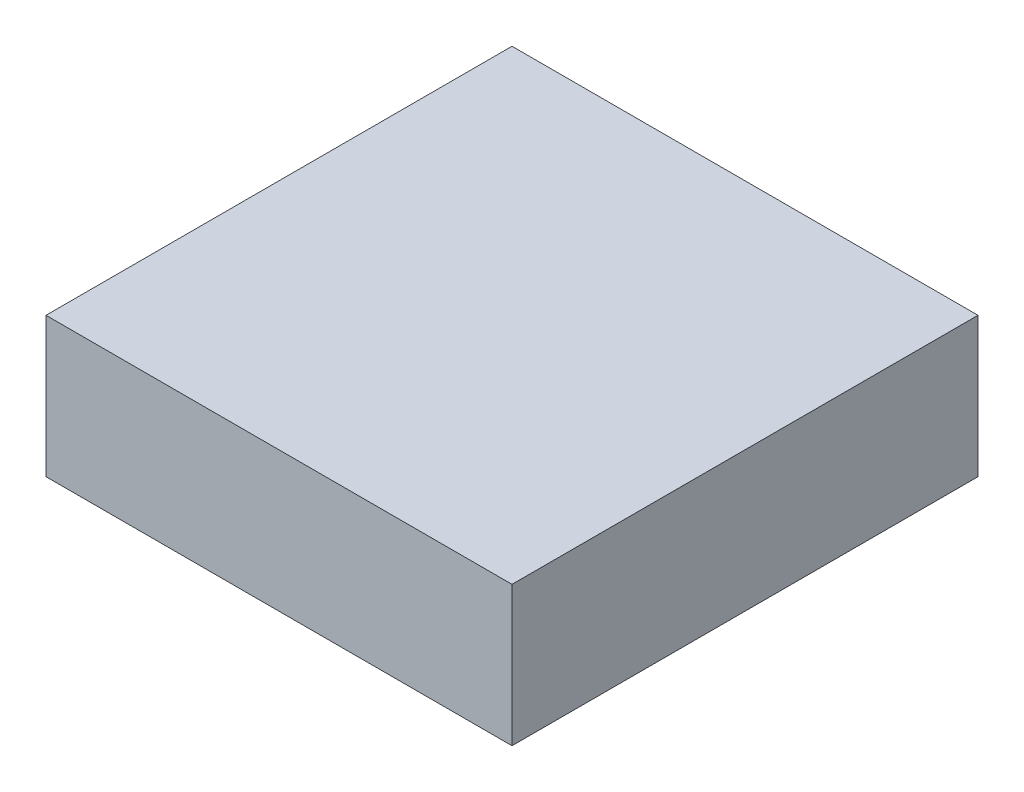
SolidWorks part; units mm, degrees
ref_plane "Front" through (0, 0, 0) normal (0, 0, 1) x (1, 0, 0)
ref_plane "Top" through (0, 0, 0) normal (0, 1, 0) x (1, 0, 0)
ref_plane "Right" through (0, 0, 0) normal (1, 0, 0) x (0, 0, -1)
sketch "Sketch1" plane through (0, 0, 0) normal (0, 0, 1) x (1, 0, 0)
  line L4 (-2.5, 4.25) -> (-2.5, 2.75)
  line L5 (-2.5, 2.75) -> (2.5, 2.75)
  line L6 (2.5, 2.75) -> (2.5, 4.25)
  line L7 (2.5, 4.25) -> (-2.5, 4.25)
  line L8 (-2.5, 4.25) -> (-2.5, 2.75)
  line L9 (-2.5, 2.75) -> (2.5, 2.75)
  line L10 (2.5, 2.75) -> (2.5, 4.25)
  line L11 (2.5, 4.25) -> (-2.5, 4.25)
  dimension "D1" = 0
extrude "Extrude1" add sketch "Sketch1" along normal blind 5
sketch "Sketch2" plane through (0, 2.75, 0) normal (0, -1, 0) x (1, 0, 0)
  line L0 (-2.5, 3) -> (2.5, 3)
  line L1 (-2.5, 5) -> (-2.5, 0) construction
  line L2 (2.5, 5) -> (2.5, 0) construction
  line L3 (-2.5, 5) -> (2.5, 5) construction
  dimension "D1" = 2
